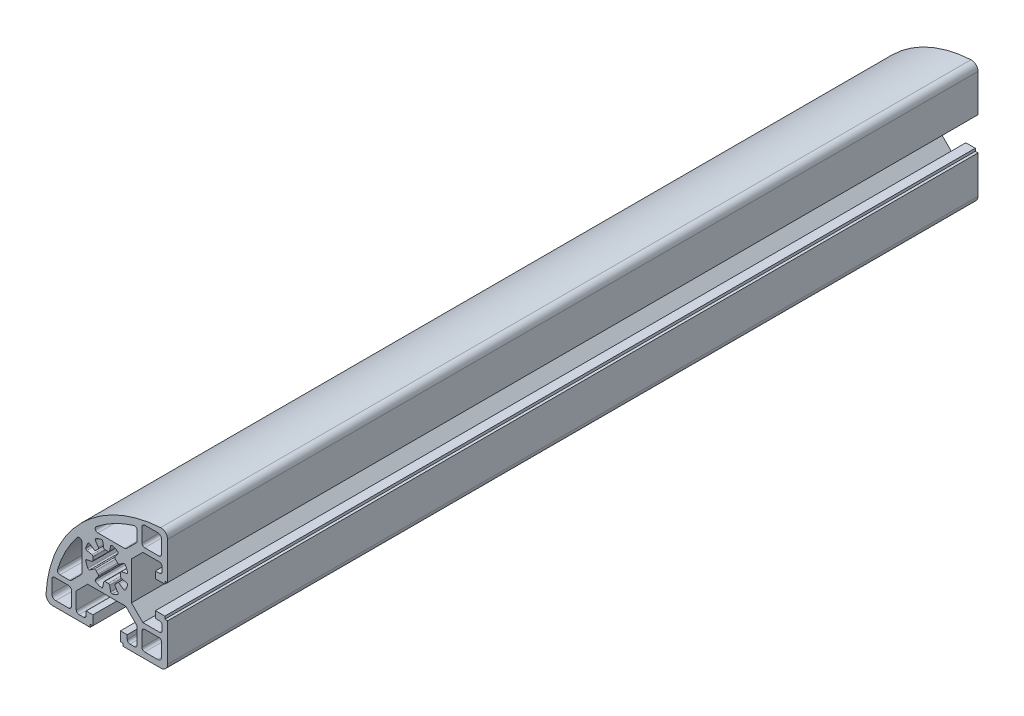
SolidWorks part; units mm, degrees
ref_plane "前视基准面" through (0, 0, 0) normal (0, 0, 1) x (1, 0, 0)
ref_plane "上视基准面" through (0, 0, 0) normal (0, 1, 0) x (1, 0, 0)
ref_plane "右视基准面" through (0, 0, 0) normal (1, 0, 0) x (0, 0, -1)
sketch "草图1" plane through (0, 0, 0) normal (0, 0, 1) x (1, 0, 0)
  line B0 (13.0706, 14.0722) -> (13.0706, 19.3305)
  line B1 (19.3305, 13.0706) -> (14.0722, 13.0706)
  line B2 (14.0722, 20.332) -> (18.8297, 20.332)
  line B3 (20.332, 18.8297) -> (20.332, 14.0722)
  line B4 (13.0706, -19.3305) -> (13.0706, -14.0722)
  line B5 (14.0722, -13.0706) -> (19.3305, -13.0706)
  line B6 (18.8297, -20.332) -> (14.0722, -20.332)
  line B7 (20.332, -14.0722) -> (20.332, -18.8297)
  line B8 (-19.3305, -13.0706) -> (-14.0722, -13.0706)
  line B9 (-20.332, -18.8297) -> (-20.332, -14.0722)
  line B10 (-13.0706, -14.0722) -> (-13.0706, -19.3305)
  line B11 (-14.0722, -20.332) -> (-18.8297, -20.332)
  line B12 (10.98, 13.1047) -> (7.3247, 9.4493)
  line B13 (11.2678, 17.254) -> (11.2678, 13.7993)
  line B14 (6.63, 9.1616) -> (-3.2584, 9.1616)
  line B15 (-9.4493, -7.3247) -> (-13.1047, -10.98)
  line B16 (-9.1616, 3.2584) -> (-9.1616, -6.63)
  line B17 (-13.7993, -11.2678) -> (-17.254, -11.2678)
  line B18 (22.5355, -6.1096) -> (21.5339, -6.1096)
  line B19 (21.5339, -6.1096) -> (21.5339, -5.108)
  line B20 (21.5339, -5.108) -> (18.0284, -5.108)
  line B21 (18.0284, -5.108) -> (18.0284, -7.612)
  line B22 (18.0284, -7.612) -> (19.5308, -7.612)
  line B23 (20.5323, -8.6136) -> (20.5323, -10.2662)
  line B24 (19.5308, -11.2678) -> (13.3924, -11.2678)
  line B25 (13.3924, -11.2678) -> (9.1616, -7.0369)
  line B26 (9.1616, -7.0369) -> (9.1616, 7.0369)
  line B27 (9.1616, 7.0369) -> (13.3924, 11.2678)
  line B28 (13.3924, 11.2678) -> (19.5308, 11.2678)
  line B29 (20.5323, 10.2662) -> (20.5323, 8.6136)
  line B30 (19.5308, 7.612) -> (18.0284, 7.612)
  line B31 (18.0284, 7.612) -> (18.0284, 5.108)
  line B32 (18.0284, 5.108) -> (21.5339, 5.108)
  line B33 (21.5339, 5.108) -> (21.5339, 6.1096)
  line B34 (21.5339, 6.1096) -> (22.5355, 6.1096)
  line B35 (22.5355, 6.1096) -> (22.5355, 20.0087)
  line B36 (-20.0087, -22.5355) -> (-6.1096, -22.5355)
  line B37 (-6.1096, -22.5355) -> (-6.1096, -21.5339)
  line B38 (-6.1096, -21.5339) -> (-5.108, -21.5339)
  line B39 (-5.108, -21.5339) -> (-5.108, -18.0284)
  line B40 (-5.108, -18.0284) -> (-7.612, -18.0284)
  line B41 (-7.612, -18.0284) -> (-7.612, -19.5308)
  line B42 (-8.6136, -20.5323) -> (-10.2662, -20.5323)
  line B43 (-11.2678, -19.5308) -> (-11.2678, -13.3924)
  line B44 (-11.2678, -13.3924) -> (-7.0369, -9.1616)
  line B45 (-7.0369, -9.1616) -> (7.0369, -9.1616)
  line B46 (7.0369, -9.1616) -> (11.2678, -13.3924)
  line B47 (11.2678, -13.3924) -> (11.2678, -19.5308)
  line B48 (10.2662, -20.5323) -> (8.6136, -20.5323)
  line B49 (7.612, -19.5308) -> (7.612, -18.0284)
  line B50 (7.612, -18.0284) -> (5.108, -18.0284)
  line B51 (5.108, -18.0284) -> (5.108, -21.5339)
  line B52 (5.108, -21.5339) -> (6.1096, -21.5339)
  line B53 (6.1096, -21.5339) -> (6.1096, -22.5355)
  line B54 (6.1096, -22.5355) -> (20.0316, -22.5355)
  line B55 (22.5355, -20.0316) -> (22.5355, -6.1096)
  line B56 (-6.232, 4.1641) -> (-4.645, 3.1037)
  line B57 (-5.4791, 1.0899) -> (-7.3511, 1.4622)
  line B58 (-3.1037, 4.645) -> (-4.1641, 6.232)
  line B59 (-7.3511, -1.4622) -> (-5.4791, -1.0899)
  line B60 (-1.4622, 7.3511) -> (-1.0899, 5.4791)
  line B61 (-4.645, -3.1037) -> (-6.232, -4.1641)
  line B62 (1.0899, 5.4791) -> (1.4622, 7.3511)
  line B63 (-4.1641, -6.232) -> (-3.1037, -4.645)
  line B64 (4.1641, 6.232) -> (3.1037, 4.645)
  line B65 (-1.0899, -5.4791) -> (-1.4622, -7.3511)
  line B66 (4.645, 3.1037) -> (6.232, 4.1641)
  line B67 (1.4622, -7.3511) -> (1.0899, -5.4791)
  line B68 (7.3511, 1.4622) -> (5.4791, 1.0899)
  line B69 (3.1037, -4.645) -> (4.1641, -6.232)
  line B70 (5.4791, -1.0899) -> (7.3511, -1.4622)
  line B71 (6.232, -4.1641) -> (4.645, -3.1037)
  arc B72 (13.0706, 14.0722) -> (14.0722, 13.0706) centre (14.0722, 14.0722) ccw
  arc B73 (14.0722, 20.332) -> (13.0706, 19.3305) centre (14.0722, 19.3305) ccw
  arc B74 (19.3305, 13.0706) -> (20.332, 14.0722) centre (19.3305, 14.0722) ccw
  arc B75 (20.332, 18.8297) -> (18.8297, 20.332) centre (18.8297, 18.8297) ccw
  arc B76 (14.0722, -13.0706) -> (13.0706, -14.0722) centre (14.0722, -14.0722) ccw
  arc B77 (13.0706, -19.3305) -> (14.0722, -20.332) centre (14.0722, -19.3305) ccw
  arc B78 (20.332, -14.0722) -> (19.3305, -13.0706) centre (19.3305, -14.0722) ccw
  arc B79 (18.8297, -20.332) -> (20.332, -18.8297) centre (18.8297, -18.8297) ccw
  arc B80 (-19.3305, -13.0706) -> (-20.332, -14.0722) centre (-19.3305, -14.0722) ccw
  arc B81 (-13.0706, -14.0722) -> (-14.0722, -13.0706) centre (-14.0722, -14.0722) ccw
  arc B82 (-20.332, -18.8297) -> (-18.8297, -20.332) centre (-18.8297, -18.8297) ccw
  arc B83 (-14.0722, -20.332) -> (-13.0706, -19.3305) centre (-14.0722, -19.3305) ccw
  arc B84 (10.98, 13.1047) -> (11.2678, 13.7993) centre (10.2853, 13.7993) ccw
  arc B85 (6.63, 9.1616) -> (7.3247, 9.4493) centre (6.63, 10.144) ccw
  arc B86 (11.2678, 17.254) -> (9.9963, 18.1929) centre (10.2853, 17.254) ccw
  arc B87 (-3.867, 10.9151) -> (-3.2584, 9.1616) centre (-3.2584, 10.144) ccw
  arc B88 (9.9963, 18.1929) -> (-3.867, 10.9151) centre (22.5355, -22.5355) ccw
  arc B89 (-9.4493, -7.3247) -> (-9.1616, -6.63) centre (-10.144, -6.63) ccw
  arc B90 (-13.7993, -11.2678) -> (-13.1047, -10.98) centre (-13.7993, -10.2853) ccw
  arc B91 (-9.1616, 3.2584) -> (-10.9151, 3.867) centre (-10.144, 3.2584) ccw
  arc B92 (-18.1929, -9.9963) -> (-17.254, -11.2678) centre (-17.254, -10.2853) ccw
  arc B93 (-10.9151, 3.867) -> (-18.1929, -9.9963) centre (22.5355, -22.5355) ccw
  arc B94 (20.5323, -8.6136) -> (19.5308, -7.612) centre (19.5308, -8.6136) ccw
  arc B95 (19.5308, -11.2678) -> (20.5323, -10.2662) centre (19.5308, -10.2662) ccw
  arc B96 (20.5323, 10.2662) -> (19.5308, 11.2678) centre (19.5308, 10.2662) ccw
  arc B97 (19.5308, 7.612) -> (20.5323, 8.6136) centre (19.5308, 8.6136) ccw
  arc B98 (22.5355, 20.0087) -> (19.938, 22.4606) centre (20.0795, 20.0087) ccw
  arc B99 (19.938, 22.4606) -> (-22.4606, -19.938) centre (22.5355, -22.5355) ccw
  arc B100 (-22.4606, -19.938) -> (-20.0087, -22.5355) centre (-20.0087, -20.0795) ccw
  arc B101 (-8.6136, -20.5323) -> (-7.612, -19.5308) centre (-8.6136, -19.5308) ccw
  arc B102 (-11.2678, -19.5308) -> (-10.2662, -20.5323) centre (-10.2662, -19.5308) ccw
  arc B103 (10.2662, -20.5323) -> (11.2678, -19.5308) centre (10.2662, -19.5308) ccw
  arc B104 (7.612, -19.5308) -> (8.6136, -20.5323) centre (8.6136, -19.5308) ccw
  arc B105 (20.0316, -22.5355) -> (22.5355, -20.0316) centre (20.0316, -20.0316) ccw
  arc B106 (-6.232, 4.1641) -> (-6.9442, 3.9975) centre (-6.5102, 3.7477) ccw
  arc B107 (-4.645, 3.1037) -> (-3.9768, 3.2058) centre (-4.3667, 3.52) ccw
  arc B108 (-6.9442, 3.9975) -> (-7.737, 2.0836) centre (0, 0) ccw
  arc B109 (-3.2058, 3.9768) -> (-3.9768, 3.2058) centre (0, 0) ccw
  arc B110 (-7.737, 2.0836) -> (-7.3511, 1.4622) centre (-7.2534, 1.9534) ccw
  arc B111 (-3.2058, 3.9768) -> (-3.1037, 4.645) centre (-3.52, 4.3667) ccw
  arc B112 (-5.0789, 0.5452) -> (-5.4791, 1.0899) centre (-5.5768, 0.5987) ccw
  arc B113 (-3.9975, 6.9442) -> (-4.1641, 6.232) centre (-3.7477, 6.5102) ccw
  arc B114 (-5.0789, 0.5452) -> (-5.0789, -0.5452) centre (0, 0) ccw
  arc B115 (-2.0836, 7.737) -> (-3.9975, 6.9442) centre (0, 0) ccw
  arc B116 (-5.4791, -1.0899) -> (-5.0789, -0.5452) centre (-5.5768, -0.5987) ccw
  arc B117 (-1.4622, 7.3511) -> (-2.0836, 7.737) centre (-1.9534, 7.2534) ccw
  arc B118 (-7.3511, -1.4622) -> (-7.737, -2.0836) centre (-7.2534, -1.9534) ccw
  arc B119 (-1.0899, 5.4791) -> (-0.5452, 5.0789) centre (-0.5987, 5.5768) ccw
  arc B120 (-7.737, -2.0836) -> (-6.9442, -3.9975) centre (0, 0) ccw
  arc B121 (0.5452, 5.0789) -> (-0.5452, 5.0789) centre (0, 0) ccw
  arc B122 (-6.9442, -3.9975) -> (-6.232, -4.1641) centre (-6.5102, -3.7477) ccw
  arc B123 (0.5452, 5.0789) -> (1.0899, 5.4791) centre (0.5987, 5.5768) ccw
  arc B124 (-3.9768, -3.2058) -> (-4.645, -3.1037) centre (-4.3667, -3.52) ccw
  arc B125 (2.0836, 7.737) -> (1.4622, 7.3511) centre (1.9534, 7.2534) ccw
  arc B126 (-3.9768, -3.2058) -> (-3.2058, -3.9768) centre (0, 0) ccw
  arc B127 (3.9975, 6.9442) -> (2.0836, 7.737) centre (0, 0) ccw
  arc B128 (-3.1037, -4.645) -> (-3.2058, -3.9768) centre (-3.52, -4.3667) ccw
  arc B129 (4.1641, 6.232) -> (3.9975, 6.9442) centre (3.7477, 6.5102) ccw
  arc B130 (-4.1641, -6.232) -> (-3.9975, -6.9442) centre (-3.7477, -6.5102) ccw
  arc B131 (3.1037, 4.645) -> (3.2058, 3.9768) centre (3.52, 4.3667) ccw
  arc B132 (-3.9975, -6.9442) -> (-2.0836, -7.737) centre (0, 0) ccw
  arc B133 (3.9768, 3.2058) -> (3.2058, 3.9768) centre (0, 0) ccw
  arc B134 (-2.0836, -7.737) -> (-1.4622, -7.3511) centre (-1.9534, -7.2534) ccw
  arc B135 (3.9768, 3.2058) -> (4.645, 3.1037) centre (4.3667, 3.52) ccw
  arc B136 (-0.5452, -5.0789) -> (-1.0899, -5.4791) centre (-0.5987, -5.5768) ccw
  arc B137 (6.9442, 3.9975) -> (6.232, 4.1641) centre (6.5102, 3.7477) ccw
  arc B138 (-0.5452, -5.0789) -> (0.5452, -5.0789) centre (0, 0) ccw
  arc B139 (7.737, 2.0836) -> (6.9442, 3.9975) centre (0, 0) ccw
  arc B140 (1.0899, -5.4791) -> (0.5452, -5.0789) centre (0.5987, -5.5768) ccw
  arc B141 (7.3511, 1.4622) -> (7.737, 2.0836) centre (7.2534, 1.9534) ccw
  arc B142 (1.4622, -7.3511) -> (2.0836, -7.737) centre (1.9534, -7.2534) ccw
  arc B143 (5.4791, 1.0899) -> (5.0789, 0.5452) centre (5.5768, 0.5987) ccw
  arc B144 (2.0836, -7.737) -> (3.9975, -6.9442) centre (0, 0) ccw
  arc B145 (5.0789, -0.5452) -> (5.0789, 0.5452) centre (0, 0) ccw
  arc B146 (3.9975, -6.9442) -> (4.1641, -6.232) centre (3.7477, -6.5102) ccw
  arc B147 (5.0789, -0.5452) -> (5.4791, -1.0899) centre (5.5768, -0.5987) ccw
  arc B148 (3.2058, -3.9768) -> (3.1037, -4.645) centre (3.52, -4.3667) ccw
  arc B149 (7.737, -2.0836) -> (7.3511, -1.4622) centre (7.2534, -1.9534) ccw
  arc B150 (3.2058, -3.9768) -> (3.9768, -3.2058) centre (0, 0) ccw
  arc B151 (6.9442, -3.9975) -> (7.737, -2.0836) centre (0, 0) ccw
  arc B152 (4.645, -3.1037) -> (3.9768, -3.2058) centre (4.3667, -3.52) ccw
  arc B153 (6.232, -4.1641) -> (6.9442, -3.9975) centre (6.5102, -3.7477) ccw
sketch_block_instance "A$C21DC21F3-1"
sketch_block "A$C21DC21F3"
extrude "凸台-拉伸1" add sketch "草图1" along normal mid plane 300
